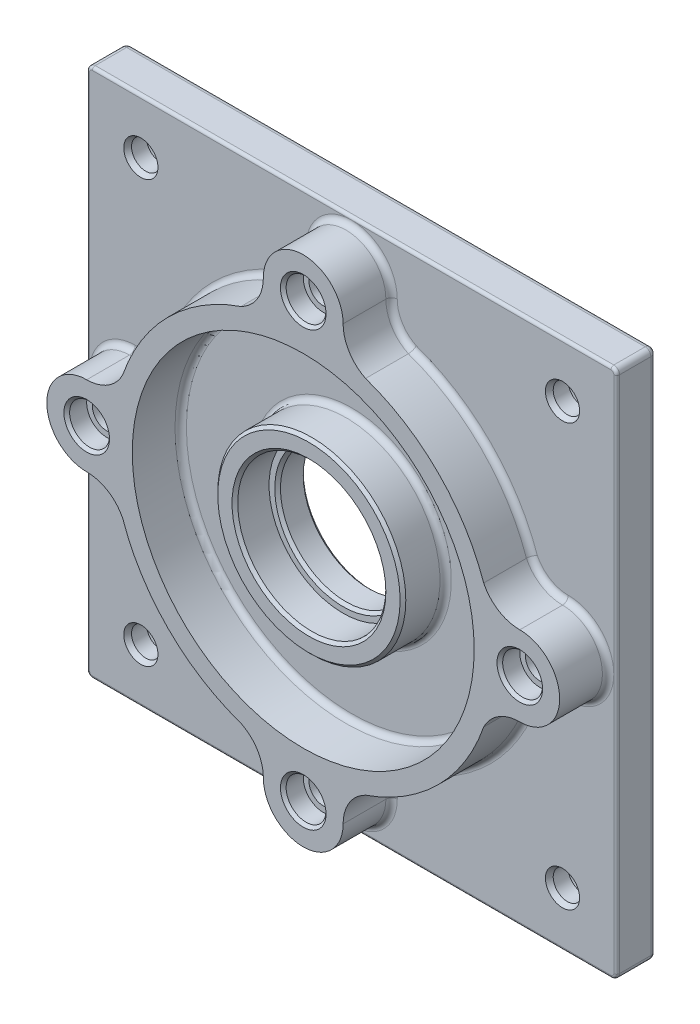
SolidWorks part; units mm, degrees
ref_plane "Přední rovina" through (0, 0, 0) normal (0, 0, 1) x (1, 0, 0)
ref_plane "Horní rovina" through (0, 0, 0) normal (0, 1, 0) x (1, 0, 0)
ref_plane "Pravá rovina" through (0, 0, 0) normal (1, 0, 0) x (0, 0, -1)
sketch "Skica1" plane through (0, 0, 0) normal (0, 0, 1) x (1, 0, 0)
  line L0 (0, -93) -> (0, 93) construction
  line L1 (-93, 0) -> (93, 0) construction
  line L2 (-93, 93) -> (93, 93)
  line L3 (93, 93) -> (93, -93)
  line L4 (-93, 93) -> (-93, -93)
  line L5 (-93, -93) -> (93, -93)
  circle A3 centre (0, 0) radius 23
  point P8 (0, 0)
  dimension "D1" = 186
  dimension "D3" = 46
  dimension "D2" = 186
extrude "Přidat vysunutím3" add sketch "Skica1" along normal blind 7
sketch "Skica2" plane through (0, 0, 7) normal (0, 0, 1) x (1, 0, 0)
  line L0 (0, 0) -> (0, 67) construction
  line L1 (0, 0) -> (67, 0) construction
  line L2 (0, 67) -> (0, 76) construction
  circle A0 centre (0, 0) radius 60
  arc A1 (-21.8792, 63.3269) -> (-63.3269, 21.8792) centre (0, 0) ccw
  arc A2 (14, 76) -> (-14, 76) centre (0, 76) ccw
  arc A3 (-14, 76) -> (-21.8792, 63.3269) centre (-27.9998, 75.9182) cw
  arc A4 (14, 76) -> (21.8792, 63.3269) centre (27.9998, 75.9182) ccw
  arc A5 (76, 14) -> (63.3269, 21.8792) centre (75.9182, 27.9998) cw
  arc A6 (76, -14) -> (76, 14) centre (76, 0) ccw
  arc A7 (76, -14) -> (63.3269, -21.8792) centre (75.9182, -27.9998) ccw
  arc A8 (14, -76) -> (21.8792, -63.3269) centre (27.9998, -75.9182) cw
  arc A9 (-14, -76) -> (14, -76) centre (0, -76) ccw
  arc A10 (-14, -76) -> (-21.8792, -63.3269) centre (-27.9998, -75.9182) ccw
  arc A11 (-76, -14) -> (-63.3269, -21.8792) centre (-75.9182, -27.9998) cw
  arc A12 (-76, 14) -> (-76, -14) centre (-76, 0) ccw
  arc A13 (-76, 14) -> (-63.3269, 21.8792) centre (-75.9182, 27.9998) ccw
  arc A14 (-63.3269, -21.8792) -> (-21.8792, -63.3269) centre (0, 0) ccw
  arc A15 (63.3269, 21.8792) -> (21.8792, 63.3269) centre (0, 0) ccw
  arc A16 (21.8792, -63.3269) -> (63.3269, -21.8792) centre (0, 0) ccw
  point P36 (0, 0)
  dimension "D1" = 14
  dimension "D2" = 120
  dimension "D3" = 14
  dimension "D4" = 4
  dimension "D5" = 67
extrude "Přidat vysunutím4" add sketch "Skica2" along normal blind 17
sketch "Skica3" plane through (0, 0, 0) normal (0, 0, -1) x (-1, 0, 0)
  line L0 (-93, 93) -> (93, 93)
  line L1 (93, 93) -> (93, -93)
  line L2 (93, -93) -> (-93, -93)
  line L3 (-93, -93) -> (-93, 93)
  line L5 (-86, 86) -> (86, 86)
  line L6 (-86, 86) -> (-86, -86)
  line L7 (-86, -86) -> (86, -86)
  line L8 (86, 86) -> (86, -86)
  dimension "D1" = 7
  dimension "D2" = 7
  dimension "D3" = 7
  dimension "D4" = 186
  dimension "D6" = 7
extrude "Přidat vysunutím5" add sketch "Skica3" along normal blind 7
sketch "Skica4" plane through (0, 0, 24) normal (0, 0, 1) x (1, 0, 0)
  line L0 (0, 0) -> (0, 67) construction
  line L1 (0, 67) -> (0, 76) construction
  circle A0 centre (0, 76) radius 5
  circle A1 centre (76, 0) radius 5
  circle A2 centre (0, -76) radius 5
  circle A3 centre (-76, 0) radius 5
  point P14 (0, 0)
  dimension "D2" = 10
  dimension "D1" = 67
  dimension "D3" = 4
extrude "Odebrat vysunutím1" cut sketch "Skica4" against normal up to surface (24 mm away)
sketch "Skica5" plane through (0, 0, 0) normal (0, 0, -1) x (-1, 0, 0)
  circle A0 centre (0, 76) radius 9
  circle A2 centre (0, 76) radius 5
  circle A3 centre (76, 0) radius 9
  circle A4 centre (76, 0) radius 5
  circle A5 centre (0, -76) radius 9
  circle A6 centre (0, -76) radius 5
  circle A7 centre (-76, 0) radius 9
  circle A8 centre (-76, 0) radius 5
  point P16 (0, 0)
  dimension "D1" = 18
  dimension "D2" = 10
  dimension "D3" = 4
extrude "Odebrat vysunutím2" cut sketch "Skica5" against normal blind 7
sketch "Skica6" plane through (0, 0, 7) normal (0, 0, 1) x (1, 0, 0)
  circle A0 centre (0, 0) radius 33
  circle A1 centre (0, 0) radius 26
  dimension "D1" = 66
  dimension "D2" = 52
extrude "Přidat vysunutím6" add sketch "Skica6" along normal blind 15
sketch "Skica7" plane through (0, 0, 7) normal (0, 0, 1) x (1, 0, 0)
  circle A0 centre (0, 0) radius 23
  circle A1 centre (0, 0) radius 26
  dimension "D1" = 52
  dimension "D2" = 46
extrude "Přidat vysunutím7" add sketch "Skica7" along normal blind 3
sketch "Skica8" plane through (0, 0, 0) normal (0, 0, -1) x (-1, 0, 0)
  line L0 (0, 0) -> (0, 86) construction
  line L2 (86, 86) -> (-86, 86) construction
  line L4 (74, 57) -> (86, 57)
  line L5 (86, -86) -> (86, 86) construction
  line L6 (86, 0) -> (0, 0) construction
  line L7 (86, 86) -> (86, 57)
  line L8 (86, 86) -> (57, 86)
  line L9 (57, -74) -> (57, -86)
  line L10 (57, 74) -> (57, 86)
  line L11 (86, -86) -> (57, -86)
  line L12 (86, -86) -> (86, -57)
  line L13 (74, -57) -> (86, -57)
  line L14 (-74, -57) -> (-86, -57)
  line L15 (-86, -86) -> (-86, -57)
  line L16 (-86, -86) -> (-57, -86)
  line L17 (-57, 74) -> (-57, 86)
  line L18 (-57, -74) -> (-57, -86)
  line L19 (-86, 86) -> (-57, 86)
  line L20 (-86, 86) -> (-86, 57)
  line L21 (-74, 57) -> (-86, 57)
  arc A0 (57, 74) -> (74, 57) centre (74, 74) ccw
  arc A1 (57, -74) -> (74, -57) centre (74, -74) cw
  arc A2 (-57, -74) -> (-74, -57) centre (-74, -74) ccw
  arc A3 (-57, 74) -> (-74, 57) centre (-74, 74) cw
  dimension "D3" = 17
  dimension "D1" = 12
  dimension "D2" = 12
extrude "Přidat vysunutím8" add sketch "Skica8" along normal blind 7
sketch "Skica10" plane through (0, 0, -7) normal (0, 0, -1) x (-1, 0, 0)
  line L0 (0, 0) -> (0, 93) construction
  line L1 (93, 93) -> (-93, 93) construction
  line L3 (93, -93) -> (93, 93) construction
  line L4 (93, 0) -> (0, 0) construction
  circle A0 centre (-74, 74) radius 5
  circle A1 centre (74, 74) radius 5
  circle A2 centre (74, -74) radius 5
  circle A3 centre (-74, -74) radius 5
  dimension "D1" = 10
extrude "Odebrat vysunutím3" cut sketch "Skica10" against normal up to surface (14 mm away)
sketch "Skica11" plane through (0, 0, -7) normal (0, 0, -1) x (-1, 0, 0)
  line L0 (0, 93) -> (0, 0) construction
  line L1 (93, 93) -> (-93, 93) construction
  line L2 (0, 0) -> (93, 0) construction
  line L3 (93, -93) -> (93, 93) construction
  circle A0 centre (-74, 74) radius 5
  circle A1 centre (-74, 74) radius 10
  circle A2 centre (74, 74) radius 10
  circle A3 centre (74, 74) radius 5
  circle A4 centre (74, -74) radius 5
  circle A5 centre (74, -74) radius 10
  circle A6 centre (-74, -74) radius 10
  circle A7 centre (-74, -74) radius 5
  dimension "D1" = 10
  dimension "D2" = 20
extrude "Odebrat vysunutím4" cut sketch "Skica11" against normal blind 7
sketch "Skica12" plane through (0, 0, 24) normal (0, 0, 1) x (1, 0, 0)
  circle A1 centre (0, 76) radius 5
  circle A2 centre (0, 76) radius 7
  circle A3 centre (76, 0) radius 7
  circle A4 centre (76, 0) radius 5
  circle A5 centre (0, -76) radius 7
  circle A6 centre (0, -76) radius 5
  circle A7 centre (-76, 0) radius 7
  circle A8 centre (-76, 0) radius 5
  point P17 (0, 0)
  dimension "D1" = 10
  dimension "D2" = 14
  dimension "D3" = 4
extrude "Odebrat vysunutím5" cut sketch "Skica12" against normal blind 7
fillet "Zaoblit1" radius 2 42 edges at (-57, 80, 0) (-80, 57, 0) (-86, 0, 0) (-80, -57, 0) (-57, -80, 0) (0, -86, 0) (57, -80, 0) (80, -57, 0) (86, 0, 0) (80, 57, 0) (61.9792, 61.9792, 0) (0, 86, 0) (-61.9792, 61.9792, 0) (-61.9792, -61.9792, 0) (61.9792, -61.9792, 0) (57, 80, 0) (16.1103, 68.5262, 7) (47.3762, 47.3762, 7) (68.5262, 16.1103, 7) (90, 0, 7) (68.5262, -16.1103, 7) (47.3762, -47.3762, 7) (16.1103, -68.5262, 7) (0, -90, 7) (-16.1103, -68.5262, 7) (0, 90, 7) (-16.1103, 68.5262, 7) (-47.3762, -47.3762, 7) (-68.5262, -16.1103, 7) (-90, 0, 7) (-68.5262, 16.1103, 7) (-47.3762, 47.3762, 7) (-33, 0, 7) (60, 0, 7) (-93, -93, 0) (93, -93, 0) (93, 93, 0) (-93, 93, 0) (0, 93, -7) (93, 0, -7) (0, -93, -7) (-93, 0, -7)
fillet "Zaoblit2" radius 1 8 edges at (93, 0, 7) (0, 93, 7) (-93, 0, 7) (0, -93, 7) (92.4142, -92.4142, 7) (-92.4142, -92.4142, 7) (-92.4142, 92.4142, 7) (92.4142, 92.4142, 7)
chamfer "Zkosení2" distance 1 angle 45 20 edges at (26, 0, 22) (33, 0, 22) (23, 0, 10) (23, 0, 0) (83, 0, 24) (7, 76, 24) (-69, 0, 24) (7, -76, 24) (-85, 0, 0) (-67, 0, 0) (0, -85, 0) (0, -67, 0) (85, 0, 0) (67, 0, 0) (0, 85, 0) (0, 67, 0) (64, 74, -7) (-64, 74, -7) (-84, -74, -7) (84, -74, -7)
chamfer "Zkosení3" distance 1 angle 60 8 edges at (-79, 74, 7) (-79, -74, 7) (69, 74, 7) (69, -74, 7) (71, 0, 7) (-5, 76, 7) (-81, 0, 7) (-5, -76, 7)
